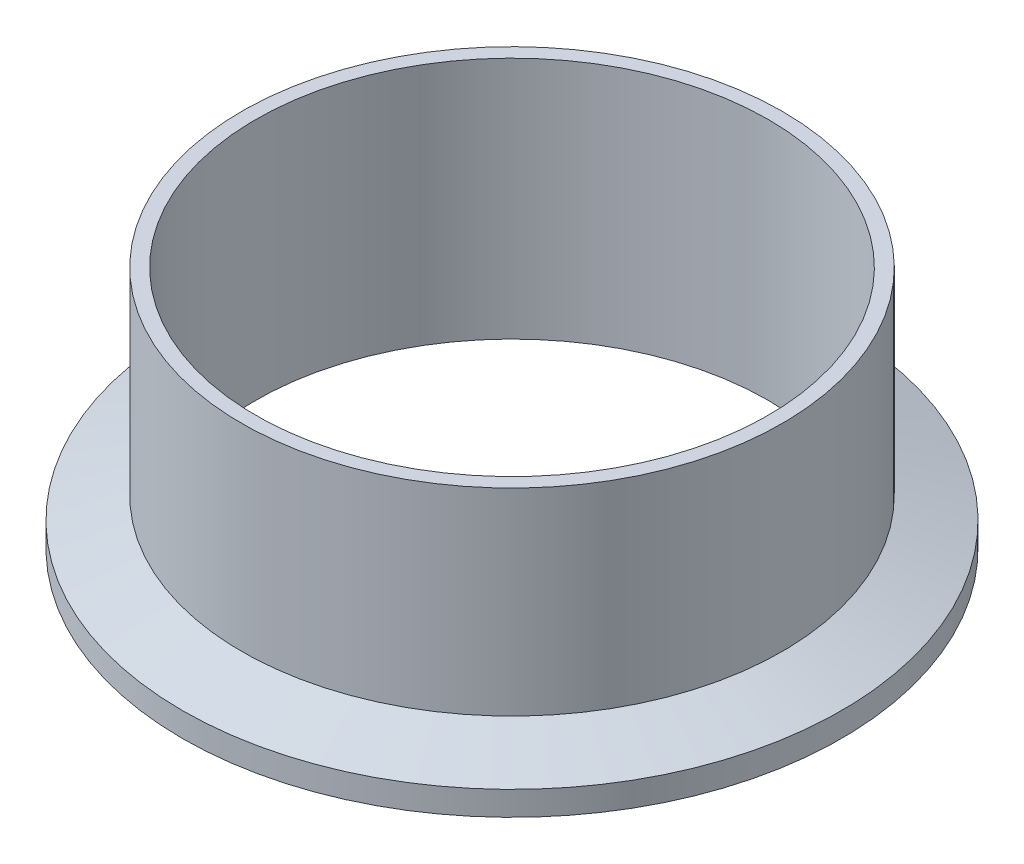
SolidWorks part; units mm, degrees
ref_plane "Front Plane" through (0, 0, 0) normal (0, 0, 1) x (1, 0, 0)
ref_plane "Top Plane" through (0, 0, 0) normal (0, 1, 0) x (1, 0, 0)
ref_plane "Right Plane" through (0, 0, 0) normal (1, 0, 0) x (0, 0, -1)
sketch "Sketch1" plane through (0, 0, 0) normal (0, 0, 1) x (1, 0, 0)
  line L0 (0, 0) -> (0, 28.575) construction
  line L1 (0, 28.575) -> (-31.75, 28.575)
  line L2 (-31.75, 28.575) -> (-31.75, 5.3779)
  line L3 (-31.75, 5.3779) -> (-38.7096, 2.8448)
  line L4 (-38.7096, 2.8448) -> (-38.7096, 0)
  line L5 (-38.7096, 0) -> (-37.1367, 0)
  line L6 (-33.5007, 0) -> (0, 0)
  line L7 (0, 0) -> (0, 28.575)
  line L8 (0, 28.575) -> (-30.099, 28.575)
  line L9 (-30.099, 28.575) -> (-30.099, 0)
  line L10 (-30.099, 0) -> (0, 0)
  line L11 (0, 0) -> (-0.1846, 0.0129)
  arc A0 (-36.4142, 0.4745) -> (-34.2232, 0.4745) centre (-35.3187, 0) cw
  arc A1 (-33.5007, 0) -> (-34.2232, 0.4745) centre (-33.5007, 0.7874) cw
  arc A2 (-36.4142, 0.4745) -> (-37.1367, 0) centre (-37.1367, 0.7874) cw
  point P12 (-34.1249, 0)
  dimension "D6" = 1.1938
  dimension "D7" = 0.7874
  dimension "D1" = 31.75
  dimension "D2" = 2.8448
  dimension "D3" = 38.7096
  dimension "D4" = 70
  dimension "D5" = 35.3187
  dimension "D8" = 1.651
  dimension "D9" = 28.575
revolve "Revolve2" add sketch "Sketch1" angle 360 about L0
